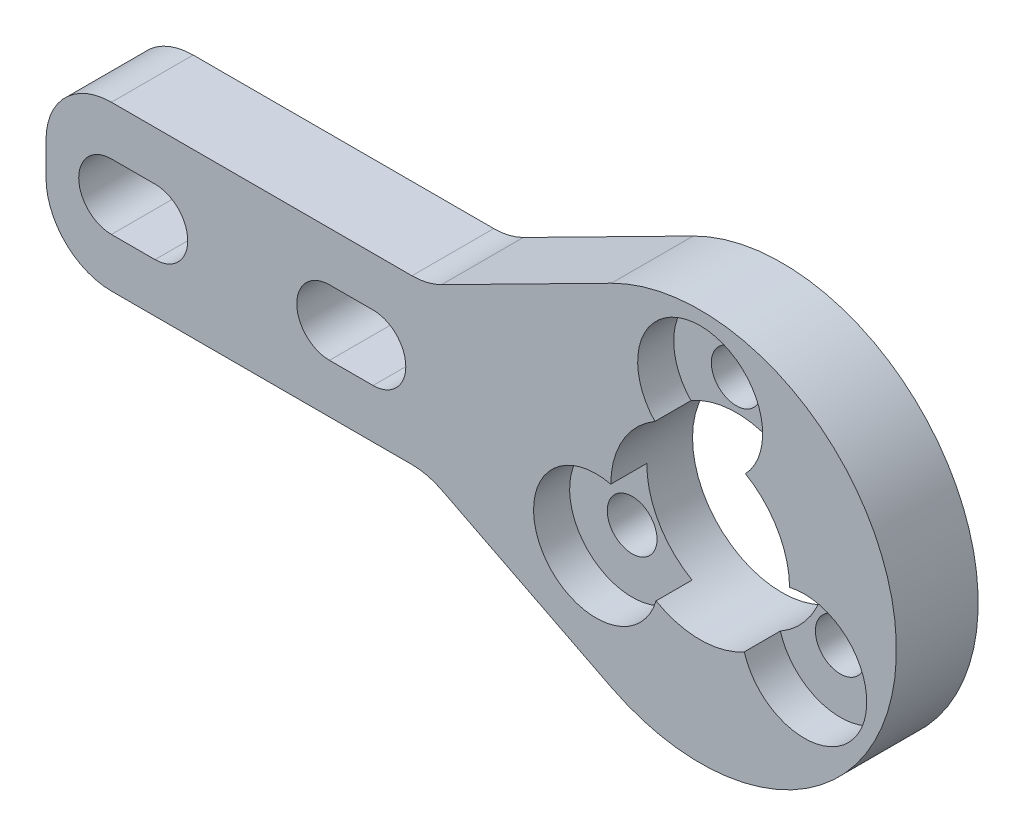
SolidWorks part; units mm, degrees
ref_plane "Front" through (0, 0, 0) normal (0, 0, 1) x (1, 0, 0)
ref_plane "Top" through (0, 0, 0) normal (0, 1, 0) x (1, 0, 0)
ref_plane "Right" through (0, 0, 0) normal (1, 0, 0) x (0, 0, -1)
sketch "Sketch1" plane through (0, 0, 0) normal (0, 0, 1) x (1, 0, 0)
  line L0 (-5.1717, 10.1931) -> (-15.875, 4.7625)
  line L1 (-5.1717, -10.1931) -> (-15.875, -4.7625)
  line L3 (0, 0) -> (-26.0334, 0) construction
  line L4 (-15.875, 4.7625) -> (-38.1, 4.7625)
  line L6 (-15.875, -4.7625) -> (-38.1, -4.7625)
  line L7 (-38.1, 4.7625) -> (-38.1, -4.7625)
  circle A0 centre (0, 0) radius 5.207
  arc A1 (-5.1717, -10.1931) -> (-5.1717, 10.1931) centre (0, 0) ccw
  dimension "D1" = 10.414
  dimension "D2" = 11.43
  dimension "D3" = 38.1
  dimension "D4" = 9.525
  dimension "D5" = 15.875
extrude "Extrude1" add sketch "Sketch1" along normal blind 4.7625
hole_wizard "CBORE for M2.5 Hex Head Machine Screw1" positions "Sketch3" profile "Sketch2" counterbore size "M2.5" standard "Ansi Metric"
sketch "Sketch3" plane through (0, 0, 4.7625) normal (0, 0, 1) x (1, 0, 0)
  line L0 (0, 0) -> (0, 13.9111) construction
  line L2 (0, 0) -> (6.0622, -3.5) construction
  circle A0 centre (0, 0) radius 7 construction
  point P0 (0, 7)
  point P13 (6.0622, -3.5)
  point P22 (-6.0622, -3.5)
  dimension "D2" = 14
  dimension "D1" = 120
sketch "Sketch2" plane through (0, 7, 4.7625) normal (1, 0, 0) x (0, -1, 0)
  line L0 (0, 0) -> (0, 4.7625)
  line L1 (0, 4.7625) -> (1.45, 4.7625)
  line L3 (1.45, 4.7625) -> (1.45, 2.1)
  line L4 (1.45, 2.1) -> (3.64, 2.1)
  line L5 (3.64, 2.1) -> (3.64, 0)
  line L7 (3.64, 0) -> (0, 0)
  line L11 (0, -6.35) -> (0, 107.95) construction
  dimension "Thru Hole Dia." = 2.9
  dimension "Thru Hole Depth" = 4.7625
  dimension "C'Bore Dia." = 7.28
  dimension "C'Bore Depth" = 2.1
sketch "Sketch4" plane through (0, 0, 4.7625) normal (0, 0, 1) x (1, 0, 0)
  line L0 (-34.29, 1.905) -> (-31.75, 1.905)
  line L1 (-31.75, -1.905) -> (-34.29, -1.905)
  line L2 (0, 0) -> (-31.75, 0) construction
  line L3 (-26.67, 0) -> (-26.67, 10.6669) construction
  line L4 (-21.59, -1.905) -> (-19.05, -1.905)
  line L5 (-19.05, 1.905) -> (-21.59, 1.905)
  arc A0 (-31.75, 1.905) -> (-31.75, -1.905) centre (-31.75, 0) cw
  arc A1 (-34.29, -1.905) -> (-34.29, 1.905) centre (-34.29, 0) cw
  arc A2 (-19.05, -1.905) -> (-19.05, 1.905) centre (-19.05, 0) ccw
  arc A3 (-21.59, 1.905) -> (-21.59, -1.905) centre (-21.59, 0) ccw
  dimension "D1" = 3.81
  dimension "D2" = 12.7
  dimension "D3" = 2.54
  dimension "D4" = 19.05
extrude "Cut-Extrude1" cut sketch "Sketch4" against normal through all
fillet "Fillet3" radius 3.81 4 edges at (-38.1, 4.7625, 2.3813) (-15.875, -4.7625, 2.3813) (-15.875, 4.7625, 2.3813) (-38.1, -4.7625, 2.3813)
